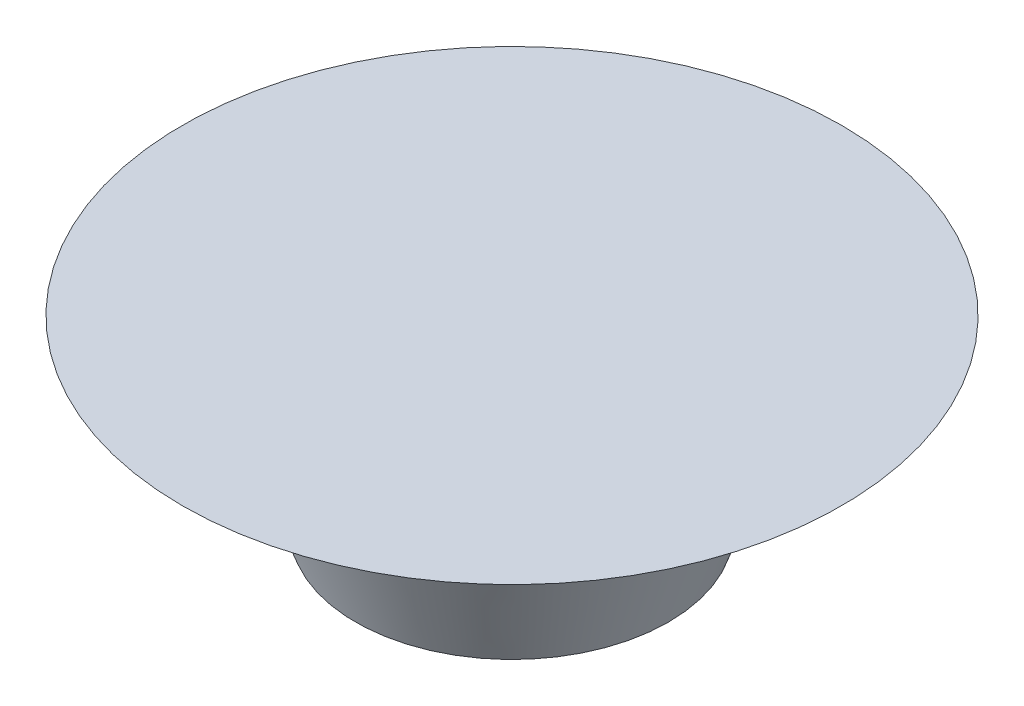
SolidWorks part; units mm, degrees
ref_plane "Plane1" through (0, 0, 0) normal (0, 0, 1) x (1, 0, 0)
ref_plane "Plane2" through (0, 0, 0) normal (0, 1, 0) x (1, 0, 0)
ref_plane "Plane3" through (0, 0, 0) normal (1, 0, 0) x (0, 0, -1)
sketch "Sketch1" plane through (0, 0, 0) normal (0, 0, 1) x (1, 0, 0)
  line L0 (-25, 1) -> (25, 1)
  line L1 (-25, 1) -> (-25, 0)
  line L2 (25, 0) -> (-25, 0)
  line L3 (25, 0) -> (25, 1)
  line L4 (0, 1) -> (0, 0) construction
  line L5 (50, 0) -> (-50, 0) construction
  dimension "D1" = 50
  dimension "D2" = 1
extrude "Base-Extrude" add sketch "Sketch1" along normal mid plane 50
sketch "Sketch2" plane through (0, 0, 0) normal (0, 0, 1) x (1, 0, 0)
  line L0 (0, 5.6174) -> (0, -8.5366) construction
  line L1 (0, -50) -> (0, 50) construction
  line L2 (6, 0) -> (4.1801, -5)
  line L3 (25, 0) -> (-25, 0) construction
  line L4 (4.1801, -5) -> (0, -5)
  line L5 (0, -5) -> (0, 0)
  line L6 (0, 0) -> (6, 0)
  dimension "Large Diameter" = 12
  dimension "Height from Drop Face" = 5
  dimension "Countersink Half Angle" = 20
revolve "Boss-Revolve1" add sketch "Sketch2" angle 360 about L0
fillet "Fillet1" radius 4 1 edges at (0, 0, -6)
sketch "Sketch3" plane through (25, 0, 0) normal (1, 0, 0) x (0, 0, -1)
  line L4 (25, 1) -> (-25, 1)
  line L5 (-25, 1) -> (-25, 0)
  line L6 (-25, 0) -> (25, 0)
  line L7 (25, 0) -> (25, 1)
  line L8 (25, 1) -> (-25, 1)
  line L9 (-25, 1) -> (-25, 0)
  line L10 (-25, 0) -> (25, 0)
  line L11 (25, 0) -> (25, 1)
  dimension "D1" = 0
extrude "Cut-Extrude1" cut sketch "Sketch3" against normal through all
sketch "Orientation sketch" plane through (0, 0, 0) normal (0, 1, 0) x (-1, 0, 0)
  circle A1 centre (0, 0) radius 8.8008
  circle A2 centre (0, 0) radius 8.8008
  dimension "D1" = 0
